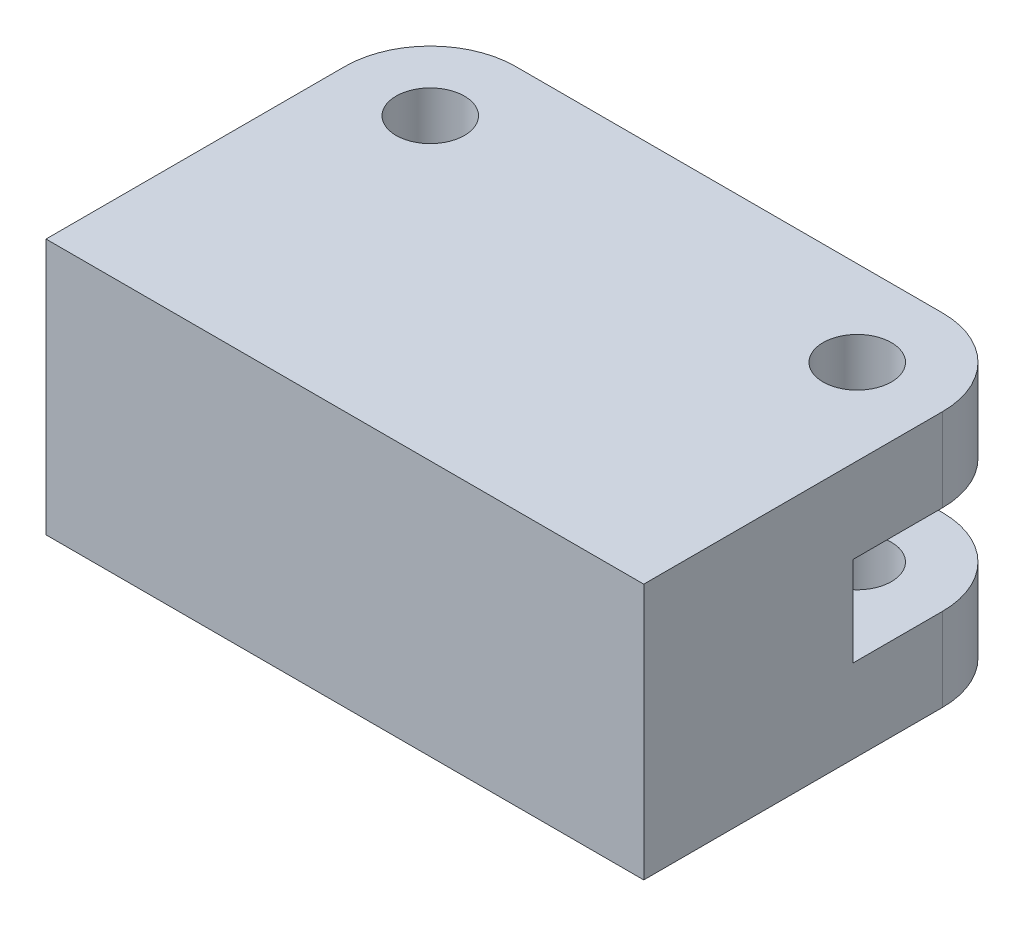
SolidWorks part; units mm, degrees
ref_plane "前视基准面" through (0, 0, 0) normal (0, 0, 1) x (1, 0, 0)
ref_plane "上视基准面" through (0, 0, 0) normal (0, 1, 0) x (1, 0, 0)
ref_plane "右视基准面" through (0, 0, 0) normal (1, 0, 0) x (0, 0, -1)
other "Configuration Table"
sketch "草图1" plane through (0, 0, 0) normal (0, 1, 0) x (1, 0, 0)
  line L1 (0, 0) -> (28, 0)
  line L2 (0, 0) -> (0, -18)
  line L3 (0, -18) -> (28, -18)
  line L4 (28, 0) -> (28, -18)
  circle A0 centre (4, -4) radius 1.6
  circle A1 centre (24, -4) radius 1.6
  dimension "D4" = 3.2
  dimension "D1" = 20
  dimension "D2" = 4
  dimension "D5" = 4
  dimension "D6" = 4
  dimension "D7" = 14
  dimension "D3" = 2
extrude "凸台-拉伸1" add sketch "草图1" along normal blind 12
sketch "草图2" plane through (0, 0, 0) normal (0, 0, -1) x (-1, 0, 0)
  line L0 (-28, 12) -> (-28, 0) construction
  line L1 (-28, 8.1) -> (0, 8.1)
  line L2 (-28, 8.1) -> (-28, 3.9)
  line L3 (-28, 3.9) -> (0, 3.9)
  line L4 (0, 8.1) -> (0, 3.9)
  line L5 (0, 12) -> (0, 0) construction
  line L6 (-28, 12) -> (0, 12) construction
  dimension "D1" = 4.2
  dimension "D2" = 3.9
extrude "切除-拉伸1" cut sketch "草图2" against normal blind 8.2
fillet "圆角1" radius 4 4 edges at (28, 1.95, 0) (28, 10.05, 0) (0, 10.05, 0) (0, 1.95, 0)
